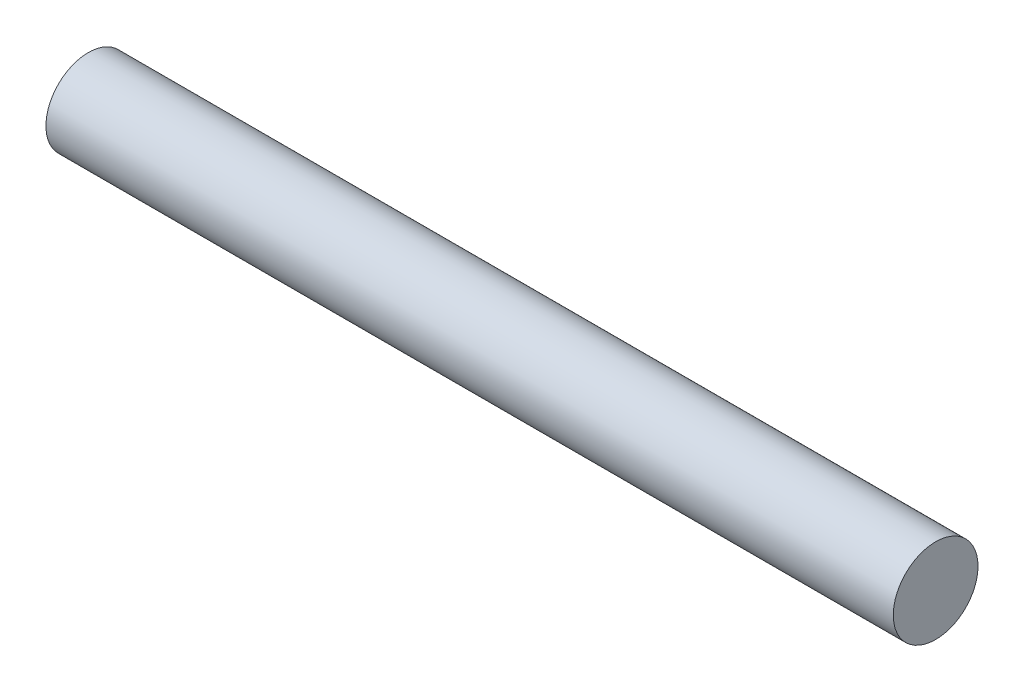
SolidWorks part; units mm, degrees
ref_plane "Płaszczyzna przednia" through (0, 0, 0) normal (0, 0, 1) x (1, 0, 0)
ref_plane "Płaszczyzna górna" through (0, 0, 0) normal (0, 1, 0) x (1, 0, 0)
ref_plane "Płaszczyzna prawa" through (0, 0, 0) normal (1, 0, 0) x (0, 0, -1)
sketch "Szkic1" plane through (0, 0, 0) normal (1, 0, 0) x (0, 0, -1)
  circle A0 centre (0, 0) radius 5
  dimension "D1" = 10
extrude "Dodanie-wyciągnięcie1" add sketch "Szkic1" along normal blind 100
